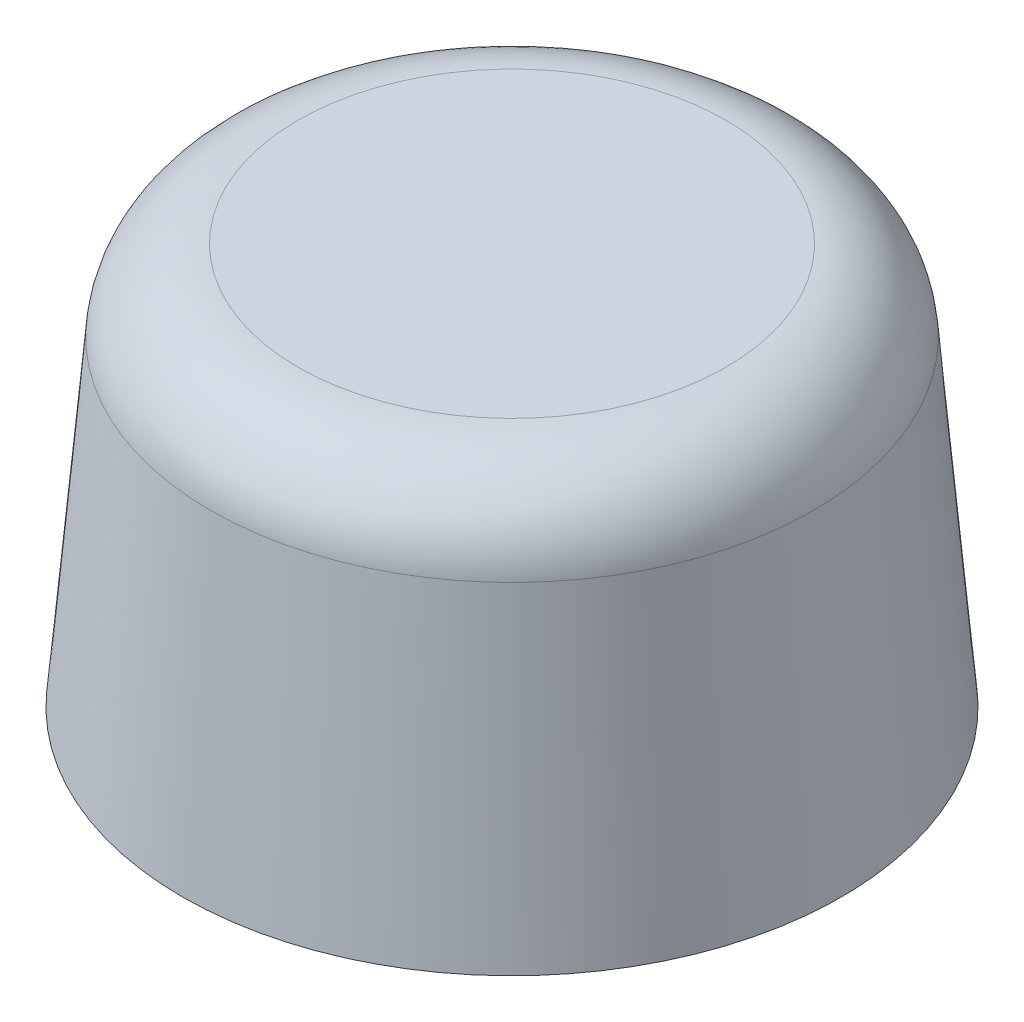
SolidWorks part; units mm, degrees
ref_plane "Front Plane" through (0, 0, 0) normal (0, 0, 1) x (1, 0, 0)
ref_plane "Top Plane" through (0, 0, 0) normal (0, 1, 0) x (1, 0, 0)
ref_plane "Right Plane" through (0, 0, 0) normal (1, 0, 0) x (0, 0, -1)
sketch "Sketch1" plane through (0, 0, 0) normal (0, 1, 0) x (1, 0, 0)
  circle A0 centre (0, 0) radius 38.1
  dimension "D1" = 76.2
extrude "Boss-Extrude1" add sketch "Sketch1" along normal blind 46.355 draft 5
fillet "Fillet1" radius 10.16 1 edges at (0, 46.355, 34.0445)
